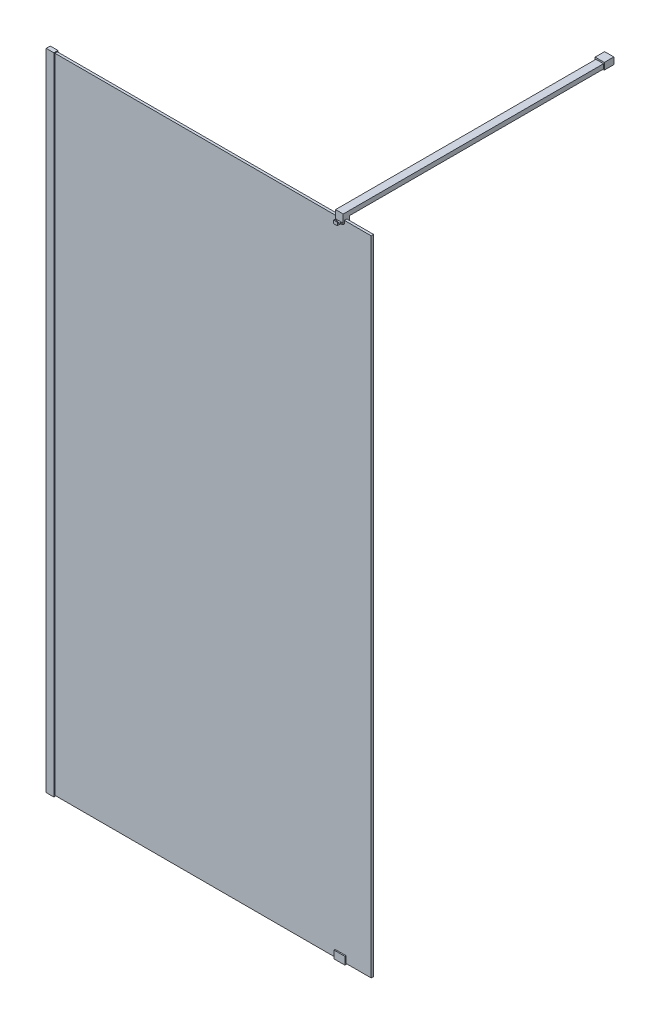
SolidWorks part; units mm, degrees
ref_plane "Płaszczyzna przednia" through (0, 0, 0) normal (0, 0, 1) x (1, 0, 0)
ref_plane "Płaszczyzna górna" through (0, 0, 0) normal (0, 1, 0) x (1, 0, 0)
ref_plane "Płaszczyzna prawa" through (0, 0, 0) normal (1, 0, 0) x (0, 0, -1)
sketch "Szkic1" plane through (0, 0, 0) normal (0, 1, 0) x (1, 0, 0)
  line L0 (0, 0) -> (0, 13.3)
  line L2 (0, 13.3) -> (25, 13.3)
  line L3 (25, 13.3) -> (25, 11.4)
  line L4 (25, 11.4) -> (11.45, 11.4)
  line L5 (11.45, 11.4) -> (11.45, 3.4)
  line L6 (11.45, 3.4) -> (25, 3.4)
  line L7 (25, 3.4) -> (25, 0)
  line L8 (25, 0) -> (0, 0)
  dimension "D1" = 13.3
  dimension "D4" = 1.9
  dimension "D5" = 8
  dimension "D6" = 3.4
  dimension "D7" = 13.55
  dimension "D8" = 25
extrude "Dodanie-wyciągnięcie1" add sketch "Szkic1" along normal blind 2100
sketch "Szkic2" plane through (0, 0, 0) normal (0, -1, 0) x (1, 0, 0)
  line L0 (11.45, -3.4) -> (1058.45, -3.4)
  line L1 (11.45, -3.4) -> (11.45, -11.4)
  line L2 (1058.45, -3.4) -> (1058.45, -11.4)
  line L3 (11.45, -11.4) -> (1058.45, -11.4)
  line L4 (11.45, -11.4) -> (25, -11.4) construction
  dimension "D1" = 1047
extrude "Dodanie-wyciągnięcie2" add sketch "Szkic2" against normal blind 2100 separate body
sketch "Szkic4" plane through (0, 2100, 0) normal (0, 1, 0) x (1, 0, 0)
  line L1 (25, 13.3) -> (0, 13.3) construction
  line L2 (25, 11.4) -> (25, 13.3) construction
  line L3 (0, 13.3) -> (0, 0) construction
  line L5 (0, 0) -> (25, 0) construction
  line L7 (25, 13.3) -> (0, 13.3)
  line L8 (25, 0) -> (25, 13.3)
  line L9 (0, 13.3) -> (0, 0)
  line L11 (0, 0) -> (25, 0)
extrude "Dodanie-wyciągnięcie3" add sketch "Szkic4" along normal blind 3
sketch "Szkic5" plane through (0, 0, 0) normal (0, -1, 0) x (1, 0, 0)
  line L1 (0, 0) -> (25, 0) construction
  line L2 (25, 0) -> (25, -3.4) construction
  line L3 (0, -13.3) -> (0, 0) construction
  line L5 (25, -13.3) -> (0, -13.3) construction
  line L7 (0, 0) -> (25, 0)
  line L8 (25, 0) -> (25, -13.3)
  line L9 (0, -13.3) -> (0, 0)
  line L11 (25, -13.3) -> (0, -13.3)
extrude "Dodanie-wyciągnięcie4" add sketch "Szkic5" along normal blind 3
ref_plane "Płaszczyzna1" through (958.45, 0, 0) normal (1, 0, 0) x (0, 0, -1)
sketch "Szkic6" plane through (958.45, 0, 0) normal (1, 0, 0) x (0, 0, -1)
  line L0 (11.4, 22) -> (15.75, 22)
  line L1 (15.75, 22) -> (15.75, -3)
  line L2 (15.75, -3) -> (-0.35, -3)
  line L3 (-0.35, -3) -> (-0.35, 22)
  line L4 (-0.35, 22) -> (3.4, 22)
  line L5 (11.4, 22) -> (11.4, 0)
  line L6 (11.4, 0) -> (11.4, 2100)
  line L7 (11.4, 0) -> (11.4, 2100) construction
  line L8 (3.4, 2100) -> (3.4, 0)
  line L9 (3.4, 2100) -> (3.4, 0) construction
  line L10 (11.4, 0) -> (3.4, 0)
  line L11 (3.4, 0) -> (3.4, 22)
  dimension "D1" = 4.35
  dimension "D2" = 25
  dimension "D3" = 3
  dimension "D4" = 3.75
extrude "Dodanie-wyciągnięcie5" add sketch "Szkic6" along normal mid plane 35 separate body
sketch "Szkic7" plane through (958.45, 0, 0) normal (1, 0, 0) x (0, 0, -1)
  line L0 (3.4, 2100) -> (3.4, 0) construction
  line L1 (-0.6, 2120) -> (19.4, 2120)
  line L2 (3.4, 2100) -> (3.4, 0) construction
  line L4 (11.4, 2100) -> (3.4, 2100) construction
  line L13 (11.4, 2100) -> (11.4, 0) construction
  line L20 (19.4, 2120) -> (19.4, 2090)
  line L25 (19.4, 2090) -> (11.4, 2090)
  line L26 (11.4, 2090) -> (11.4, 2100)
  line L27 (11.4, 2100) -> (3.4, 2100)
  line L28 (3.4, 2100) -> (3.4, 2090)
  line L29 (3.4, 2090) -> (-13.37, 2090)
  line L30 (-13.37, 2090) -> (-13.37, 2100)
  line L31 (-13.37, 2100) -> (-10.37, 2100)
  line L32 (-10.37, 2100) -> (-9.8451, 2094)
  line L33 (-9.8451, 2094) -> (-0.6, 2094)
  line L34 (-0.6, 2094) -> (-0.6, 2120)
  dimension "D3" = 20
  dimension "D4" = 30
  dimension "D5" = 16.77
  dimension "D6" = 4
  dimension "D14" = 8
  dimension "D21" = 10
  dimension "D22" = 4
  dimension "D23" = 3
  dimension "D24" = 95
extrude "Dodanie-wyciągnięcie6" add sketch "Szkic7" along normal mid plane 25 separate body
sketch "Szkic8" plane through (0, 2100, 0) normal (0, 1, 0) x (1, 0, 0)
  line L0 (945.95, -0.6) -> (952.45, -3.631)
  line L1 (952.45, -3.631) -> (952.45, -13.37)
  line L2 (970.95, -0.6) -> (964.45, -3.631)
  line L3 (964.45, -3.631) -> (964.45, -13.37)
  line L4 (958.45, -10.37) -> (958.45, 156.6902) construction
  line L5 (970.95, -10.37) -> (945.95, -10.37) construction
  line L6 (952.45, -13.37) -> (964.45, -13.37)
  line L7 (970.95, -13.37) -> (945.95, -13.37) construction
  dimension "D1" = 12
  dimension "D2" = 115
extrude "Wytnij-wyciągnięcie1" cut sketch "Szkic8" against normal through all and the other way through all
sketch "Szkic10" plane through (0, 2120, 0) normal (0, 1, 0) x (1, 0, 0)
  line L0 (958.45, 31.9) -> (958.45, 19.4) construction
  line L1 (945.95, 881.03) -> (970.95, 881.03)
  line L2 (945.95, 881.03) -> (945.95, 19.4)
  line L3 (945.95, 19.4) -> (970.95, 19.4)
  line L4 (970.95, 19.4) -> (945.95, 19.4) construction
  line L5 (945.95, 19.4) -> (945.95, -0.6) construction
  line L6 (970.95, 881.03) -> (970.95, 19.4)
  point P4 (958.45, 31.9)
  dimension "D2" = 861.63
  dimension "D1" = 25
  dimension "D3" = 12.5
extrude "Dodanie-wyciągnięcie7" add sketch "Szkic10" against normal blind 15
sketch "Szkic14" plane through (0, 0, -881.03) normal (0, 0, -1) x (-1, 0, 0)
  line L1 (-973.45, 2125) -> (-943.45, 2125)
  line L2 (-973.45, 2125) -> (-973.45, 2103)
  line L3 (-973.45, 2103) -> (-943.45, 2103)
  line L4 (-943.45, 2125) -> (-943.45, 2103)
  line L5 (-973.45, 2125) -> (-943.45, 2103) construction
  line L6 (-973.45, 2103) -> (-943.45, 2125) construction
  line L7 (-958.45, 2120) -> (-958.45, 2114) construction
  line L8 (-970.95, 2120) -> (-945.95, 2120) construction
  line L9 (-970.95, 2105) -> (-945.95, 2105) construction
  point P0 (-958.45, 2114)
  dimension "D1" = 30
  dimension "D2" = 22
  dimension "D3" = 2
extrude "Dodanie-wyciągnięcie8" add sketch "Szkic14" against normal blind 31
